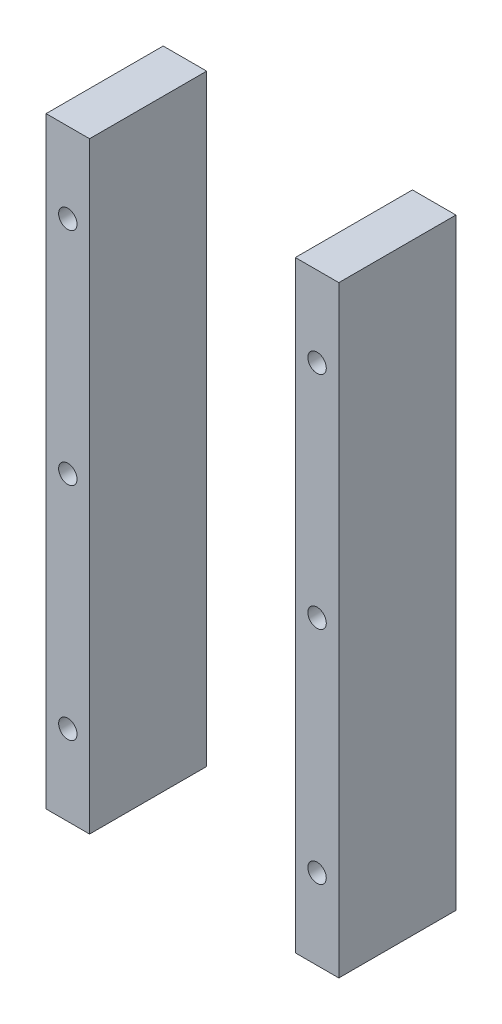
SolidWorks part; units mm, degrees
ref_plane "Alzado" through (0, 0, 0) normal (0, 0, 1) x (1, 0, 0)
ref_plane "Planta" through (0, 0, 0) normal (0, 1, 0) x (1, 0, 0)
ref_plane "Vista lateral" through (0, 0, 0) normal (1, 0, 0) x (0, 0, -1)
sketch "Croquis1" plane through (0, 0, 0) normal (0, 0, 1) x (1, 0, 0)
  line L0 (13, 180) -> (136, 180) construction
  line L1 (13, -180) -> (-13, -180)
  line L2 (13, -180) -> (13, 180)
  line L3 (13, 180) -> (-13, 180)
  line L4 (-13, -180) -> (-13, 180)
  line L5 (13, -180) -> (-13, 180) construction
  line L6 (13, 180) -> (-13, -180) construction
  line L7 (136, 180) -> (162, 180)
  line L8 (162, 180) -> (162, -180)
  line L9 (162, -180) -> (136, -180)
  line L10 (136, -180) -> (136, 180)
  point P0 (0, 0)
  dimension "D1" = 26
  dimension "D2" = 360
  dimension "D3" = 123
  dimension "D4" = 26
  dimension "D5" = 360
extrude "Saliente-Extruir1" add sketch "Croquis1" along normal blind 70
sketch "Croquis2" plane through (0, 0, 70) normal (0, 0, 1) x (1, 0, 0)
  line L0 (0, 180) -> (0, -180) construction
  line L1 (13, 180) -> (-13, 180) construction
  line L2 (-13, -180) -> (13, -180) construction
  line L3 (136, 180) -> (13, 180) construction
  line L4 (74.5, 180) -> (74.5, -180) construction
  line L5 (0, 180) -> (0, 132) construction
  line L6 (0, 0) -> (74.5, 0) construction
  circle A0 centre (0, 132) radius 5.5
  circle A1 centre (0, 0) radius 5.5
  circle A2 centre (0, -132) radius 5.5
  circle A3 centre (149, -132) radius 5.5
  circle A4 centre (149, 0) radius 5.5
  circle A5 centre (149, 132) radius 5.5
  dimension "D2" = 11
  dimension "D1" = 264
extrude "Cortar-Extruir1" cut sketch "Croquis2" against normal through all
